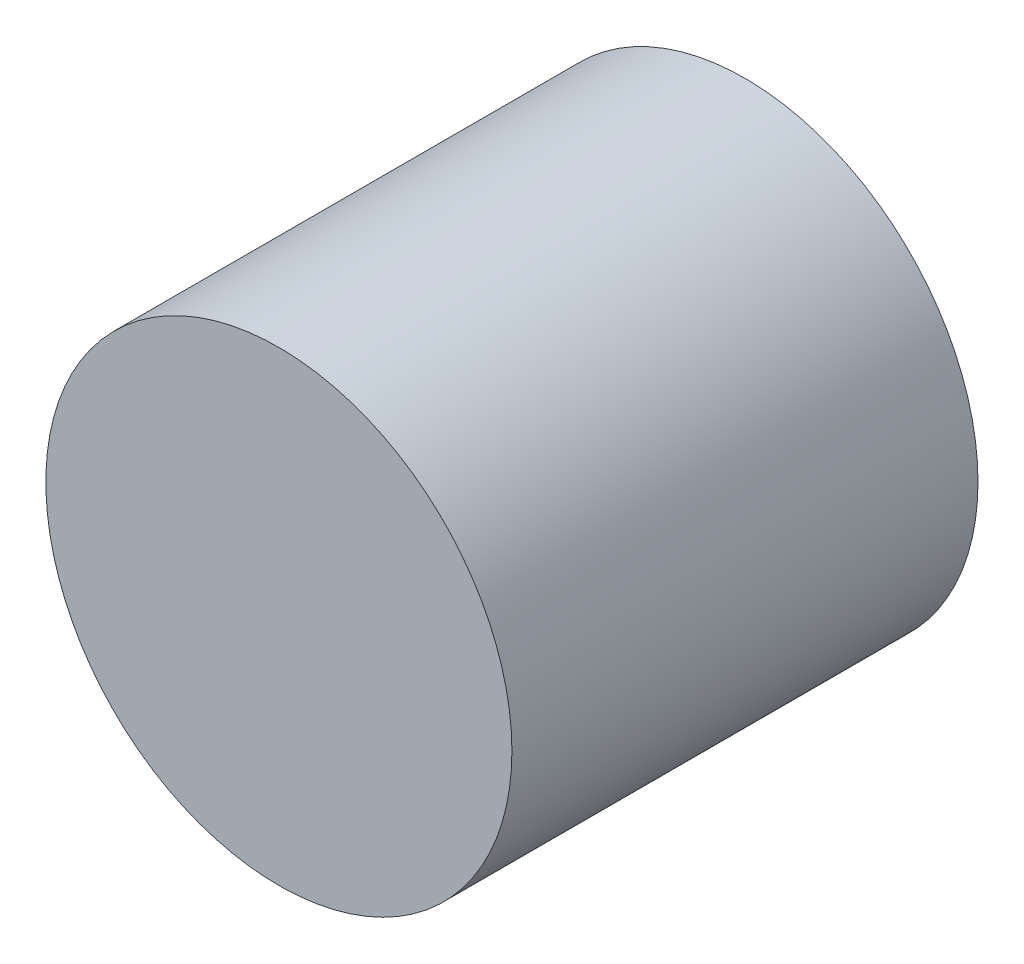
SolidWorks part; units mm, degrees
ref_plane "Ebene vorne" through (0, 0, 0) normal (0, 0, 1) x (1, 0, 0)
ref_plane "Ebene oben" through (0, 0, 0) normal (0, 1, 0) x (1, 0, 0)
ref_plane "Ebene rechts" through (0, 0, 0) normal (1, 0, 0) x (0, 0, -1)
sketch "Skizze1" plane through (0, 0, 0) normal (0, 0, 1) x (1, 0, 0)
  circle A0 centre (0, 0) radius 2.5
  dimension "D1" = 5
extrude "Linear austragen1" add sketch "Skizze1" along normal blind 5
